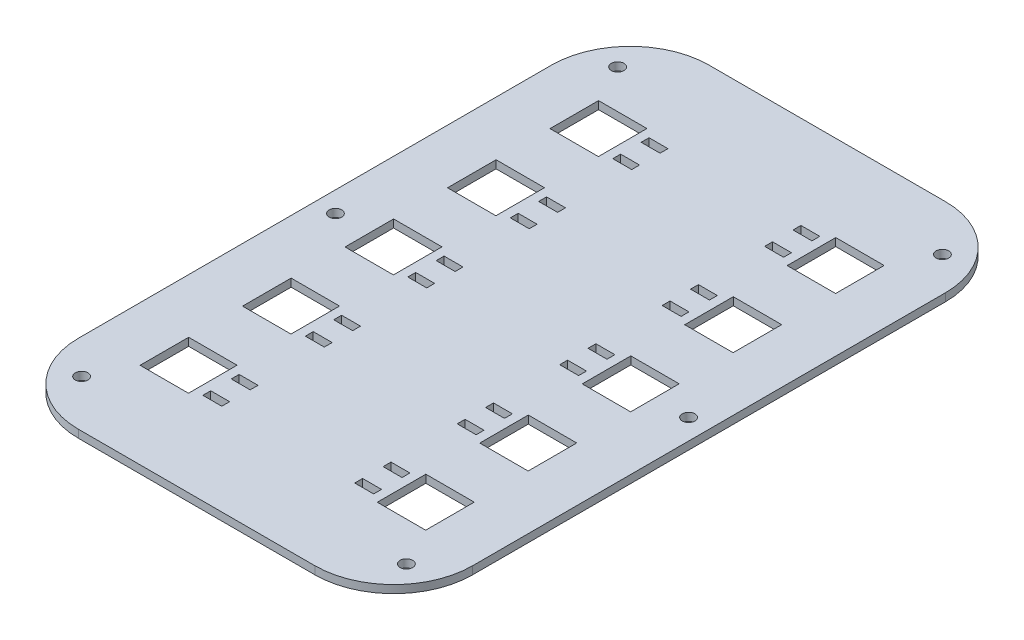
SolidWorks part; units mm, degrees
ref_plane "Front Plane" through (0, 0, 0) normal (0, 0, 1) x (1, 0, 0)
ref_plane "Top Plane" through (0, 0, 0) normal (0, 1, 0) x (1, 0, 0)
ref_plane "Right Plane" through (0, 0, 0) normal (1, 0, 0) x (0, 0, -1)
sketch "Sketch1" plane through (0, 0, 0) normal (0, 1, 0) x (1, 0, 0)
  line L1 (-75, 200) -> (75, 200)
  line L2 (-125, 150) -> (-125, -150)
  line L3 (-75, -200) -> (75, -200)
  line L4 (125, 150) -> (125, -150)
  arc A0 (-125, -150) -> (-75, -200) centre (-75, -150) ccw
  arc A1 (75, -200) -> (125, -150) centre (75, -150) ccw
  arc A2 (75, 200) -> (125, 150) centre (75, 150) cw
  arc A3 (-75, 200) -> (-125, 150) centre (-75, 150) ccw
  point P7 (-125, -200)
  point P10 (125, -200)
  point P13 (125, 200)
  dimension "D5" = 50
  dimension "D1" = 400
  dimension "D2" = 200
  dimension "D3" = 250
  dimension "D4" = 125
extrude "Boss-Extrude1" add sketch "Sketch1" along normal blind 5
sketch "Sketch3" plane through (0, 0, 0) normal (0, -1, 0) x (1, 0, 0)
  line L0 (-60.075, 145.1286) -> (-90.375, 145.1286) construction
  line L1 (-60.075, 145.1286) -> (-90.375, 145.1286)
  line L2 (-90.375, 145.1286) -> (-90.375, 114.7286) construction
  line L3 (-90.375, 114.7286) -> (-60.075, 114.7286) construction
  line L4 (-60.075, 114.7286) -> (-60.075, 145.1286) construction
  line L5 (-90.375, 145.1286) -> (-90.375, 114.7286)
  line L6 (-90.375, 114.7286) -> (-60.075, 114.7286)
  line L7 (-60.075, 114.7286) -> (-60.075, 145.1286)
  line L8 (90.375, 114.7286) -> (60.075, 114.7286) construction
  line L9 (90.375, 145.1286) -> (90.375, 114.7286) construction
  line L10 (60.075, 145.1286) -> (90.375, 145.1286) construction
  line L11 (60.075, 114.7286) -> (60.075, 145.1286) construction
  line L12 (90.375, 114.7286) -> (60.075, 114.7286)
  line L13 (90.375, 145.1286) -> (90.375, 114.7286)
  line L14 (60.075, 145.1286) -> (90.375, 145.1286)
  line L15 (60.075, 114.7286) -> (60.075, 145.1286)
  line L16 (-90.575, 145.3286) -> (-90.575, 114.5286)
  line L17 (-90.575, 114.5286) -> (-59.875, 114.5286)
  line L18 (-59.875, 114.5286) -> (-59.875, 145.3286)
  line L19 (-59.875, 145.3286) -> (-90.575, 145.3286)
  line L20 (59.875, 114.5286) -> (59.875, 145.3286)
  line L21 (59.875, 145.3286) -> (90.575, 145.3286)
  line L22 (90.575, 145.3286) -> (90.575, 114.5286)
  line L23 (90.575, 114.5286) -> (59.875, 114.5286)
  dimension "D1" = 0.2
  dimension "D2" = 0.2
extrude "Cut-Extrude1" cut sketch "Sketch3" against normal blind 10 contours L6 L7 L1 L5 | L18 L19 L16 L17 L7 L6 L5 L1 | L15 L12 L13 L14 | L23 L22 L21 L20 L12 L15 L14 L13
pattern_linear "LPattern1" count 5 spacing 65 along (0, 0, -1) of "Cut-Extrude1"
sketch "Sketch4" plane through (0, 5, 0) normal (0, 1, 0) x (1, 0, 0)
  line L0 (-36.75, -136.42) -> (-59.75, -136.42) construction
  line L1 (-36.75, -136.42) -> (-59.75, -136.42)
  line L2 (-33.75, -124.42) -> (-59.75, -124.42) construction
  line L3 (-33.75, -124.42) -> (-59.75, -124.42)
  line L4 (-42.165, -123.92) -> (-54.165, -123.92)
  line L5 (-42.165, -136.92) -> (-54.165, -136.92)
  line L6 (-54.165, -136.92) -> (-54.165, -141.92)
  line L7 (-54.165, -141.92) -> (-42.165, -141.92)
  line L8 (-42.165, -141.92) -> (-42.165, -136.92)
  line L9 (-36.75, -136.92) -> (-59.75, -136.92) construction
  line L11 (-33.75, -123.92) -> (-59.75, -123.92) construction
  line L12 (-54.165, -118.92) -> (-42.165, -118.92)
  line L17 (-54.165, -118.92) -> (-54.165, -123.92)
  line L18 (-54.165, -123.92) -> (-42.165, -123.92)
  line L19 (-42.165, -118.92) -> (-42.165, -123.92)
  line L20 (0, -200) -> (0, -445.0301) construction
  line L21 (-75, -200) -> (75, -200) construction
  line L22 (54.165, -141.92) -> (42.165, -141.92)
  line L23 (42.165, -141.92) -> (42.165, -136.92)
  line L24 (42.165, -136.92) -> (54.165, -136.92)
  line L25 (54.165, -136.92) -> (54.165, -141.92)
  line L26 (42.165, -123.92) -> (54.165, -123.92)
  line L27 (42.165, -118.92) -> (42.165, -123.92)
  line L28 (54.165, -118.92) -> (42.165, -118.92)
  line L29 (54.165, -118.92) -> (54.165, -123.92)
  line L30 (-54.165, -141.92) -> (-54.165, -136.92) construction
  dimension "D3" = 5
  dimension "D4" = 12
  dimension "D6" = 5
  dimension "D1" = 0.5
  dimension "D2" = 0.5
extrude "Cut-Extrude2" cut sketch "Sketch4" against normal blind 10 contours L7 L8 L5 L6 | L19 L12 L17 L4 | L25 L24 L23 L22 | L29 L28 L27 L26
pattern_linear "LPattern2" count 5 spacing 65 along (0, 0, -1) of "Cut-Extrude2"
sketch "Sketch5" plane through (0, 5, 0) normal (0, 1, 0) x (1, 0, 0)
  circle A0 centre (-103, 170) radius 4
  circle A1 centre (103, 170) radius 4
  circle A2 centre (103, -170) radius 4
  circle A3 centre (-103, -170) radius 4
  circle A4 centre (-112, 0) radius 4
  circle A5 centre (112, 0) radius 4
  dimension "D1" = 8
  dimension "D2" = 22
  dimension "D3" = 30
  dimension "D4" = 22
  dimension "D5" = 30
  dimension "D6" = 112
  dimension "D7" = 112
extrude "Cut-Extrude3" cut sketch "Sketch5" against normal blind 5
